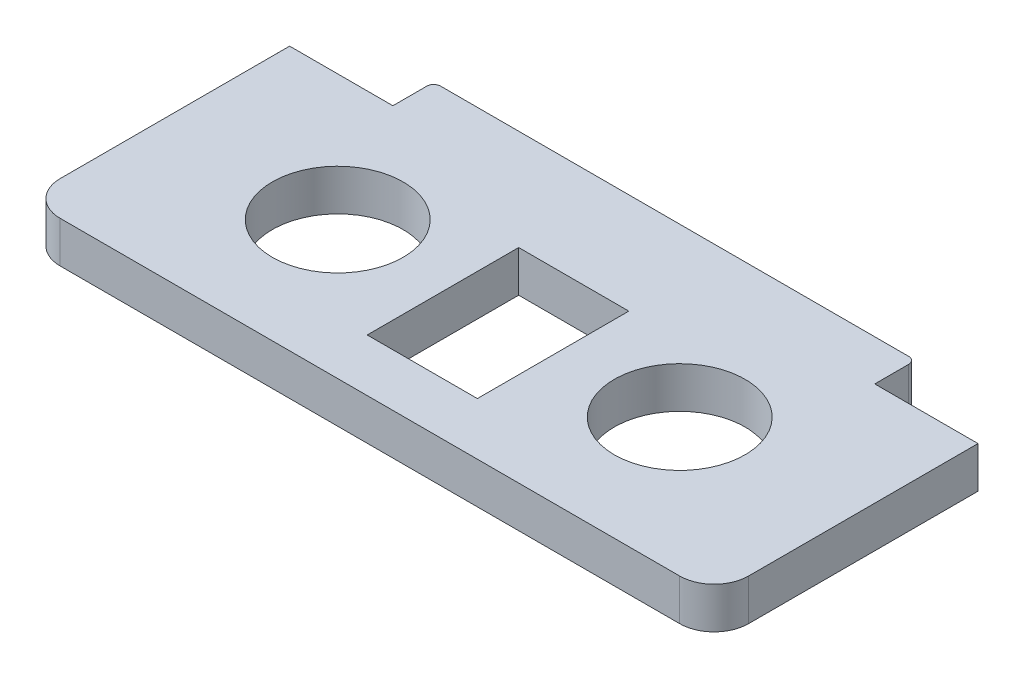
SolidWorks part; units mm, degrees
ref_plane "Front Plane" through (0, 0, 0) normal (0, 0, 1) x (1, 0, 0)
ref_plane "Top Plane" through (0, 0, 0) normal (0, 1, 0) x (1, 0, 0)
ref_plane "Right Plane" through (0, 0, 0) normal (1, 0, 0) x (0, 0, -1)
sketch "Sketch2" plane through (0, 0, 0) normal (0, 1, 0) x (1, 0, 0)
  line L0 (-50, 0) -> (50, 0) construction
  line L2 (-50, 14) -> (-50, -20)
  line L3 (-50, -20) -> (50, -20)
  line L4 (50, 14) -> (50, -20)
  line L5 (-35, 14) -> (50, -20) construction
  line L6 (-50, -20) -> (35, 14) construction
  line L7 (-8.0217, 9.6292) -> (7.9783, 9.6292)
  line L8 (7.9783, 9.6292) -> (7.9783, -12.3708)
  line L9 (7.9783, -12.3708) -> (-8.0217, -12.3708)
  line L10 (-8.0217, -12.3708) -> (-8.0217, 9.6292)
  line L16 (-50, 14) -> (-50, 18.332)
  line L17 (-50, 18.332) -> (-35, 18.332)
  line L18 (-35, 18.332) -> (-35, 24.2659)
  line L19 (-35, 24.2659) -> (35, 24.2659)
  line L20 (35, 24.2659) -> (35, 18.332)
  line L21 (35, 18.332) -> (50, 18.332)
  line L22 (50, 18.332) -> (50, 14)
  circle A0 centre (-24.68, 0) radius 9.5
  circle A1 centre (25, 0) radius 9.5
  point P0 (0, 0)
  dimension "D2" = 24.68
  dimension "D1" = 100
  dimension "D3" = 25
  dimension "D4" = 20
  dimension "D6" = 16
  dimension "D7" = 22
extrude "Boss-Extrude1" add sketch "Sketch2" along normal blind 6
fillet "Fillet9" radius 5 2 edges at (50, 3, 20) (-50, 3, 20)
fillet "Fillet10" radius 1 2 edges at (35, 3, -24.2659) (-35, 3, -24.2659)
